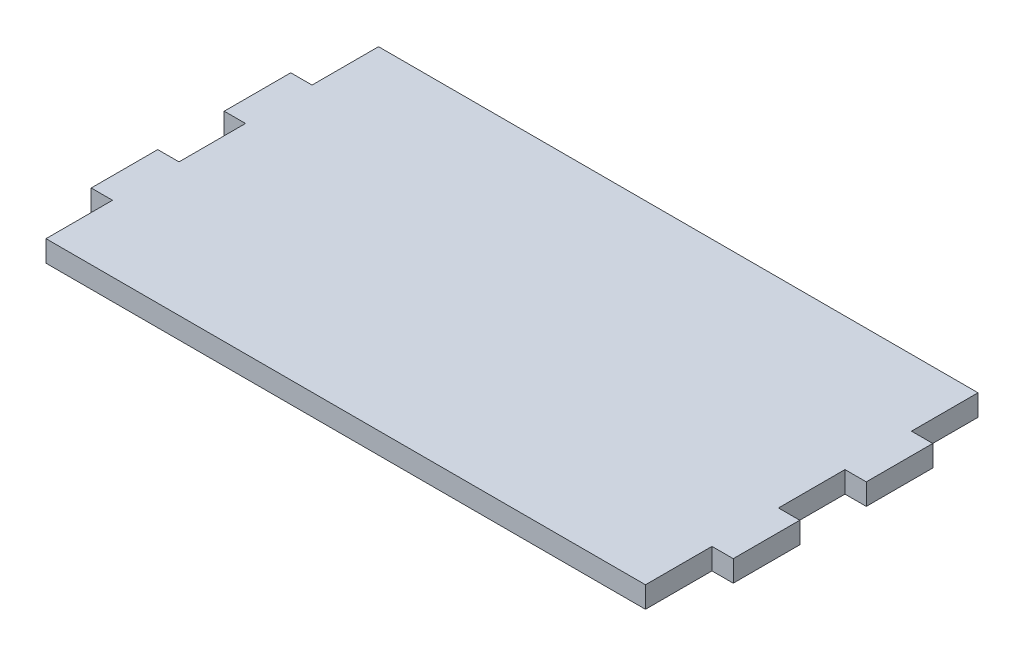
SolidWorks part; units mm, degrees
ref_plane "Alzado" through (0, 0, 0) normal (0, 0, 1) x (1, 0, 0)
ref_plane "Planta" through (0, 0, 0) normal (0, 1, 0) x (1, 0, 0)
ref_plane "Vista lateral" through (0, 0, 0) normal (1, 0, 0) x (0, 0, -1)
sketch "Croquis1" plane through (0, 0, 0) normal (0, 1, 0) x (1, 0, 0)
  line L0 (-181, 18.75) -> (-181, 56.25)
  line L1 (-169, -93.75) -> (169, -93.75)
  line L2 (-169, -93.75) -> (-169, -56.25)
  line L3 (-169, 93.75) -> (169, 93.75)
  line L5 (-169, -93.75) -> (169, 93.75) construction
  line L6 (-169, 93.75) -> (169, -93.75) construction
  line L7 (-169, -56.25) -> (-181, -56.25)
  line L9 (-169, -18.75) -> (-181, -18.75)
  line L10 (-181, -56.25) -> (-181, -18.75)
  line L11 (-169, 56.25) -> (-181, 56.25)
  line L13 (-169, 18.75) -> (-181, 18.75)
  line L18 (0, 93.75) -> (0, 142.0008) construction
  line L31 (-169, 56.25) -> (-169, 93.75)
  line L32 (169, -93.75) -> (169, -56.25)
  line L34 (169, 56.25) -> (169, 93.75)
  line L35 (-169, -18.75) -> (-169, 18.75)
  line L39 (169, -18.75) -> (169, 18.75)
  line L40 (169, 18.75) -> (181, 18.75)
  line L41 (169, 56.25) -> (181, 56.25)
  line L42 (181, -56.25) -> (181, -18.75)
  line L43 (169, -18.75) -> (181, -18.75)
  line L44 (169, -56.25) -> (181, -56.25)
  line L45 (181, 18.75) -> (181, 56.25)
  point P0 (0, 0)
extrude "Saliente-Extruir1" add sketch "Croquis1" along normal blind 12
equation "\"ancho\"= \"ancho_joint\" * 5"
equation "\"alto\"= 33.8"
equation "\"material\"= 1.2"
equation "\"ancho_joint_sep\"=3.75"
equation "\"ancho_joint\"=3.75"
equation "\"D4@Croquis1\"=\"ancho_joint\""
equation "\"D5@Croquis1\"=\"material\""
equation "\"D3@Croquis1\"=\"ancho_joint\""
equation "\"D7@Croquis1\"=\"ancho_joint\""
equation "\"D8@Croquis1\"=\"ancho_joint\""
equation "\"D1@Croquis1\"=\"alto\""
